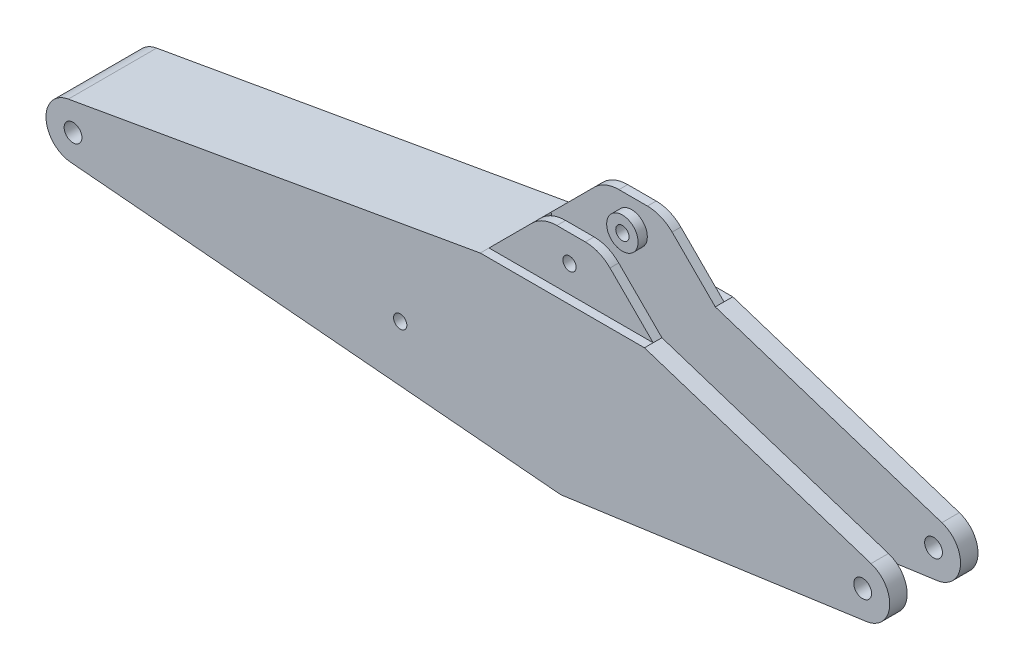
SolidWorks part; units mm, degrees
ref_plane "Front Plane" through (0, 0, 0) normal (0, 0, 1) x (1, 0, 0)
ref_plane "Top Plane" through (0, 0, 0) normal (0, 1, 0) x (1, 0, 0)
ref_plane "Right Plane" through (0, 0, 0) normal (1, 0, 0) x (0, 0, -1)
sketch "Sketch1" plane through (0, 0, 0) normal (0, 0, 1) x (1, 0, 0)
  line L0 (0, 0) -> (0, 875) construction
  line L1 (479.5451, 569) -> (173.5451, 875)
  line L2 (-2808.5024, -154.4108) -> (0, -400)
  line L3 (0, -400) -> (1751.6011, -153.4874)
  line L4 (-461.2495, 569) -> (479.5451, 569) construction
  line L5 (-2821.9221, 152.644) -> (-461.2495, 569)
  line L6 (1777.8695, 147.4229) -> (479.5451, 569)
  line L7 (173.5451, 875) -> (-155.2495, 875)
  line L8 (-155.2495, 875) -> (-461.2495, 569)
  circle A1 centre (-2795, 0) radius 155
  circle A2 centre (1730, 0) radius 155
  circle A3 centre (-2795, 0) radius 51
  circle A4 centre (1730, 0) radius 51
  circle A5 centre (0, 722) radius 90
  point P7 (0, 0)
  dimension "D3" = 310
  dimension "D4" = 310
  dimension "D5" = 102
  dimension "D6" = 102
  dimension "D9" = 180
  dimension "D1" = 4525
  dimension "D2" = 875
  dimension "D7" = 400
  dimension "D8" = 306
  dimension "D10" = 153
  dimension "D11" = 15
  dimension "D12" = 26
  dimension "D13" = 2795
  dimension "D14" = 45
  dimension "D15" = 45
  dimension "D16" = 875
extrude "Boss-Extrude1" add sketch "Sketch1" along normal mid plane 506 contours A2 L6 L1 L7 L8 L5 A1 L2 L3 A5 | A5 | A2 A4 | A1 A3
fillet "Fillet1" radius 200 2 edges at (-155.2495, 875, 0) (173.5451, 875, 0)
sketch "Sketch2" plane through (0, 0, 0) normal (0, 0, 1) x (1, 0, 0)
  line L7 (-454.3019, 529.608) -> (-461.2495, 569)
  line L8 (1024, -215.4926) -> (1024, -255.8868)
  line L9 (0, -400) -> (1751.6011, -153.4874) construction
  line L10 (1746.0267, -113.8778) -> (-1.0586, -359.7548)
  line L11 (-1.0586, -359.7548) -> (-2805.0179, -114.5628)
  line L12 (-2814.9745, 113.252) -> (-454.3019, 529.608)
  line L13 (1024, -215.4926) -> (-1.0586, -359.7548)
  line L14 (-1.0586, -359.7548) -> (-2805.0179, -114.5628)
  line L15 (-2814.9745, 113.252) -> (-454.3019, 529.608)
  line L16 (90.7024, 875) -> (-72.4068, 875)
  line L17 (-213.8282, 816.4214) -> (-461.2495, 569)
  line L18 (-461.2495, 569) -> (-2821.9221, 152.644)
  line L19 (-2808.5024, -154.4108) -> (0, -400)
  line L20 (0, -400) -> (1751.6011, -153.4874)
  line L21 (1777.8695, 147.4229) -> (479.5451, 569)
  line L22 (479.5451, 569) -> (232.1237, 816.4214)
  line L23 (90.7024, 875) -> (-72.4068, 875)
  line L24 (-213.8282, 816.4214) -> (-461.2495, 569)
  line L25 (-461.2495, 569) -> (-2821.9221, 152.644)
  line L26 (-2808.5024, -154.4108) -> (0, -400)
  line L27 (0, -400) -> (1751.6011, -153.4874)
  line L28 (1777.8695, 147.4229) -> (479.5451, 569)
  line L29 (479.5451, 569) -> (232.1237, 816.4214)
  arc A4 (-2814.9745, 113.252) -> (-2805.0179, -114.5628) centre (-2795, 0) ccw
  arc A5 (-2814.9745, 113.252) -> (-2805.0179, -114.5628) centre (-2795, 0) ccw
  arc A6 (-72.4068, 875) -> (-213.8282, 816.4214) centre (-72.4068, 675) ccw
  arc A7 (-2821.9221, 152.644) -> (-2808.5024, -154.4108) centre (-2795, 0) ccw
  arc A8 (1751.6011, -153.4874) -> (1777.8695, 147.4229) centre (1730, 0) ccw
  arc A9 (232.1237, 816.4214) -> (90.7024, 875) centre (90.7024, 675) ccw
  arc A10 (-72.4068, 875) -> (-213.8282, 816.4214) centre (-72.4068, 675) ccw
  arc A11 (-2821.9221, 152.644) -> (-2808.5024, -154.4108) centre (-2795, 0) ccw
  arc A12 (1751.6011, -153.4874) -> (1777.8695, 147.4229) centre (1730, 0) ccw
  arc A13 (232.1237, 816.4214) -> (90.7024, 875) centre (90.7024, 675) ccw
  dimension "D2" = 706
  dimension "D1" = 40
  dimension "D3" = 0
extrude "Cut-Extrude1" cut sketch "Sketch2" against normal mid plane 306 contours L29 A13 L23 A10 L24 L7 L15 A5 L14 L13 L8 L27 A12 L28
sketch "Sketch3" plane through (0, 0, 153) normal (0, 0, -1) x (-1, 0, 0)
  circle A0 centre (0, 722) radius 90
  point P2 (0, 0)
  dimension "D1" = 180
  dimension "D2" = 153
extrude "Boss-Extrude3" add sketch "Sketch3" along normal blind 53
mirror "Mirror1" about plane through (0, 0, 0) normal (0, 0, 1) of "Boss-Extrude3"
sketch "Sketch4" plane through (0, 0, -253) normal (0, 0, -1) x (-1, 0, 0)
  circle A0 centre (0, 722) radius 38
  dimension "D1" = 76
extrude "Cut-Extrude2" cut sketch "Sketch4" against normal through all
sketch "Sketch5" plane through (0, 0, -253) normal (0, 0, -1) x (-1, 0, 0)
  line L0 (-479.5451, 569) -> (461.2495, 569)
  line L1 (-479.5451, 569) -> (-232.1237, 816.4214) construction
  line L2 (-90.7024, 875) -> (72.4068, 875) construction
  line L3 (213.8282, 816.4214) -> (461.2495, 569) construction
  line L4 (-479.5451, 569) -> (-232.1237, 816.4214)
  line L5 (-90.7024, 875) -> (72.4068, 875)
  line L6 (213.8282, 816.4214) -> (461.2495, 569)
  arc A0 (-90.7024, 875) -> (-232.1237, 816.4214) centre (-90.7024, 675) ccw construction
  arc A1 (213.8282, 816.4214) -> (72.4068, 875) centre (72.4068, 675) ccw construction
  arc A2 (-90.7024, 875) -> (-232.1237, 816.4214) centre (-90.7024, 675) ccw
  arc A3 (213.8282, 816.4214) -> (72.4068, 875) centre (72.4068, 675) ccw
extrude "Cut-Extrude3" cut sketch "Sketch5" against normal blind 50
mirror "Mirror2" about plane through (0, 0, 0) normal (0, 0, 1) of "Cut-Extrude3"
sketch "Sketch6" plane through (0, 0, 153) normal (0, 0, -1) x (-1, 0, 0)
  circle A0 centre (920, 0) radius 90
  point P2 (0, 0)
  dimension "D1" = 180
  dimension "D2" = 2650
extrude "Boss-Extrude4" add sketch "Sketch6" along normal blind 53
mirror "Mirror3" about plane through (0, 0, 0) normal (0, 0, 1) of "Boss-Extrude4"
sketch "Sketch7" plane through (0, 0, 253) normal (0, 0, 1) x (1, 0, 0)
  circle A0 centre (-920, 0) radius 38
  dimension "D1" = 76
extrude "Cut-Extrude4" cut sketch "Sketch7" against normal through all both and the other way through all
